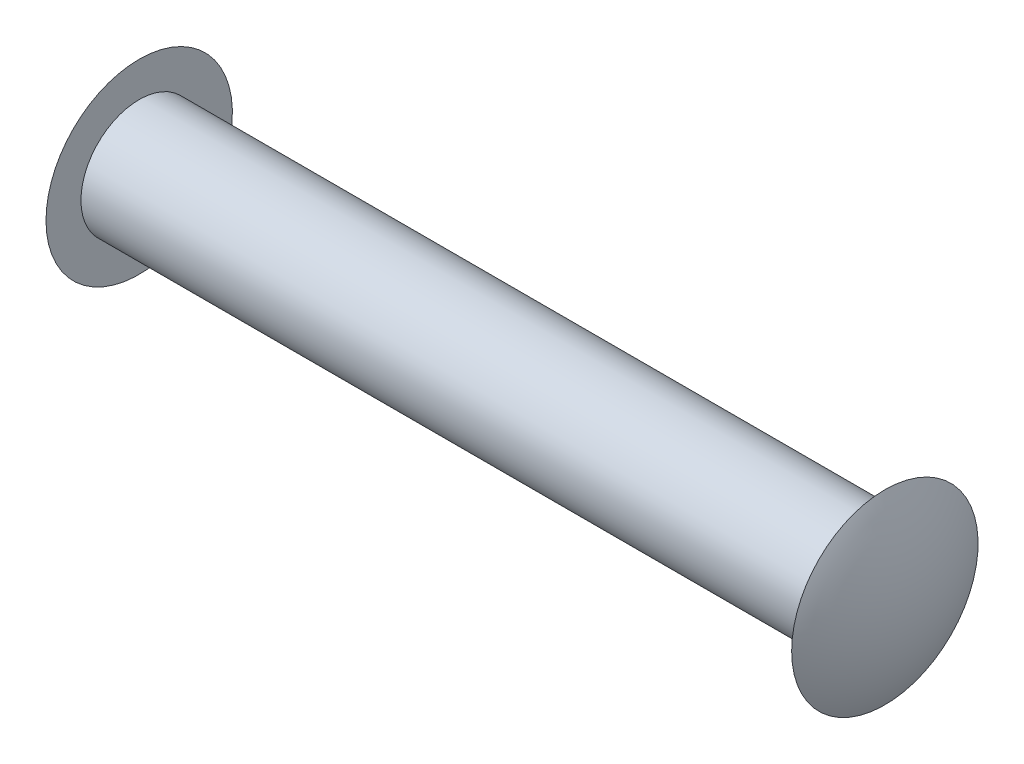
SolidWorks part; units mm, degrees
ref_plane "Front" through (0, 0, 0) normal (0, 0, 1) x (1, 0, 0)
ref_plane "Top" through (0, 0, 0) normal (0, 1, 0) x (1, 0, 0)
ref_plane "Right" through (0, 0, 0) normal (1, 0, 0) x (0, 0, -1)
sketch "Sketch1" plane through (0, 0, 0) normal (0, 0, 1) x (1, 0, 0)
  line L0 (0, 0) -> (0, 27.5993) construction
  line L1 (0, 2.5) -> (16, 2.5)
  line L2 (16, 2.5) -> (16, 4)
  line L3 (0, 0) -> (101.2692, 0) construction
  line L4 (17, 0) -> (17, -14.3402) construction
  line L5 (0, 2.5) -> (0, 0)
  line L6 (0, 0) -> (17, 0)
  arc A0 (16, 4) -> (17, 0) centre (8.5, 0) cw
  dimension "D1" = 32
  dimension "D2" = 5
  dimension "D3" = 1.5
  dimension "D4" = 1
revolve "Latch Pin- Revolve1" add sketch "Sketch1" angle 360 about L3
mirror "Mirror1" about plane through (0, 2.5, 0) normal (1, 0, 0)
